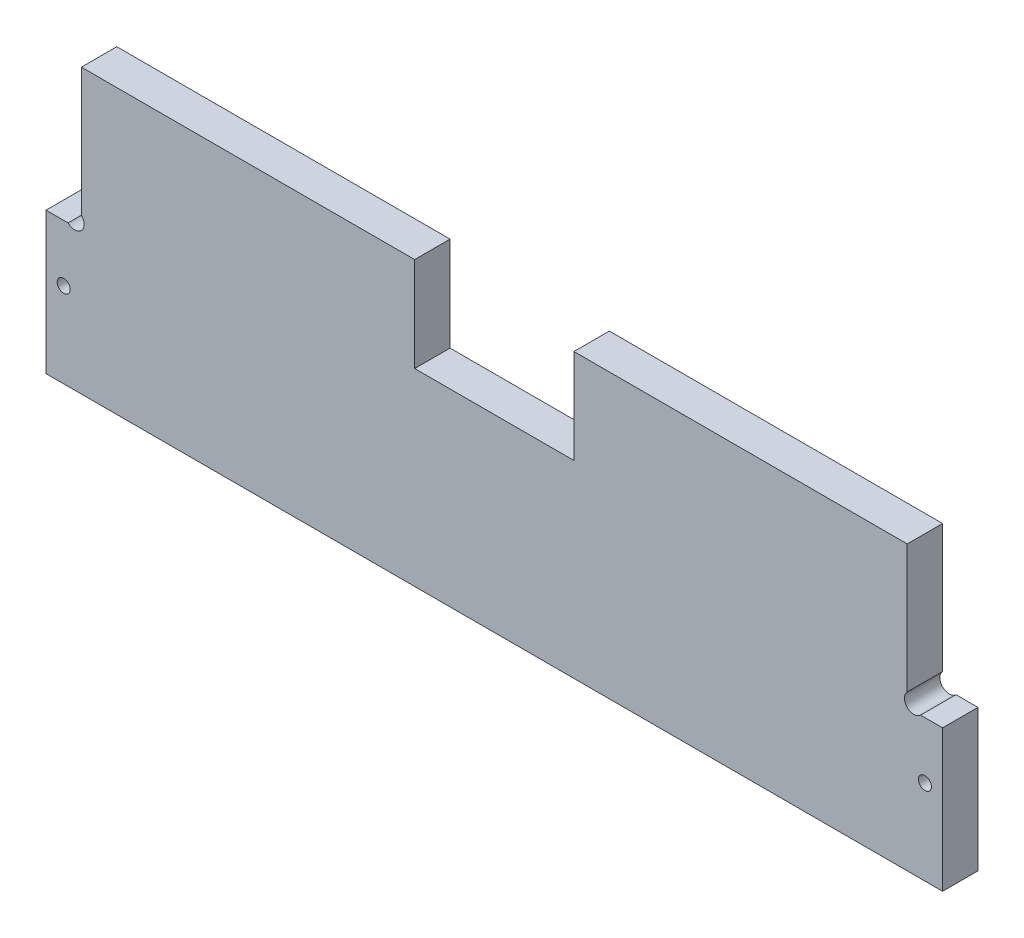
SolidWorks part; units mm, degrees
ref_plane "Plan de face" through (0, 0, 0) normal (0, 0, 1) x (1, 0, 0)
ref_plane "Plan de dessus" through (0, 0, 0) normal (0, 1, 0) x (1, 0, 0)
ref_plane "Plan de droite" through (0, 0, 0) normal (1, 0, 0) x (0, 0, -1)
sketch "Esquisse1" plane through (0, 0, 0) normal (0, 0, 1) x (1, 0, 0)
  line L0 (0, -13.5587) -> (0, 79.2909) construction
  line L1 (-79.7416, 0) -> (116.6385, 0) construction
  line L2 (76, -20.1448) -> (76, 79.2909) construction
  line L3 (-15.6148, 48) -> (116.6385, 48) construction
  line L4 (64.5492, 24) -> (104.5008, 24) construction
  line L5 (70, 21.4034) -> (70, 70.6544) construction
  line L6 (13.5, 48) -> (70, 48)
  line L7 (89.6455, 6) -> (-79.7416, 6) construction
  line L8 (70, 24) -> (85.7871, 39.7871) construction
  line L9 (76, 24) -> (76, 0)
  line L10 (70, 26.2627) -> (70, 48)
  line L11 (72.2627, 24) -> (76, 24)
  line L12 (-76, 24) -> (-76, 0)
  line L15 (-70, 26.2627) -> (-70, 48)
  line L16 (-72.2627, 24) -> (-76, 24)
  line L21 (-70, 48) -> (-13.5, 48)
  line L22 (73, 17.2749) -> (73, -9.7914) construction
  line L23 (94.2244, 14.3921) -> (70, 14.3921) construction
  line L24 (-13.5, 48) -> (-13.5, 32)
  line L25 (13.5, 32) -> (13.5, 48)
  line L26 (-13.5, 32) -> (13.5, 32)
  line L29 (76, 0) -> (-76, 0)
  arc A0 (70, 26.2627) -> (72.2627, 24) centre (71.1314, 25.1314) ccw
  circle A1 centre (73, 14.3921) radius 1.1
  circle A2 centre (-73, 14.3921) radius 1.1
  arc A3 (-70, 26.2627) -> (-72.2627, 24) centre (-71.1314, 25.1314) cw
  dimension "D1" = 24
  dimension "D2" = 48
  dimension "D3" = 76
  dimension "D4" = 6
  dimension "D5" = 6
  dimension "D6" = 3
  dimension "D7" = 9.6079
  dimension "D8" = 45
extrude "Boss.-Extru.1" add sketch "Esquisse1" along normal blind 6
